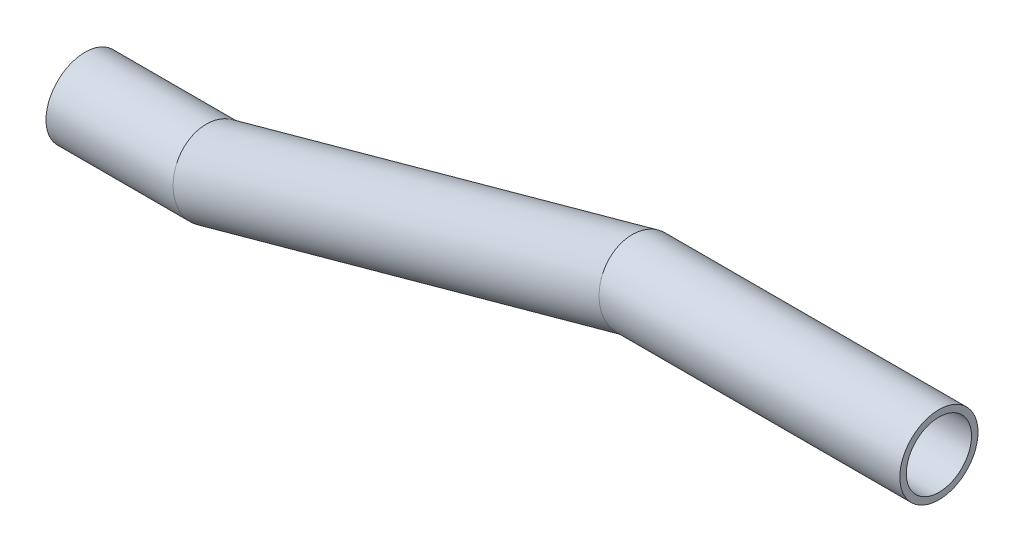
SolidWorks part; units mm, degrees
ref_plane "Ebene vorne" through (0, 0, 0) normal (0, 0, 1) x (1, 0, 0)
ref_plane "Ebene oben" through (0, 0, 0) normal (0, 1, 0) x (1, 0, 0)
ref_plane "Ebene rechts" through (0, 0, 0) normal (1, 0, 0) x (0, 0, -1)
ref_plane "Ebene1" through (-230, 0, 0) normal (1, 0, 0) x (0, 0, -1)
ref_plane "Ebene2" through (-597, 0, 0) normal (1, 0, 0) x (0, 0, -1)
ref_plane "Ebene3" through (-697, 0, 0) normal (1, 0, 0) x (0, 0, -1)
sketch "Skizze1" plane through (0, 0, 0) normal (1, 0, 0) x (0, 0, -1)
  point P0 (0, 0)
sketch "Skizze3" plane through (-230, 0, 0) normal (1, 0, 0) x (0, 0, -1)
  point P0 (0, 0)
  point P2 (0, 0)
sketch "Skizze4" plane through (-597, 0, 0) normal (1, 0, 0) x (0, 0, -1)
  point P0 (38.5, -129)
  dimension "D1" = 129
  dimension "D2" = 38.5
sketch "Skizze5" plane through (-697, 0, 0) normal (1, 0, 0) x (0, 0, -1)
  point P0 (38.5, -129)
  point P2 (38.5, -129)
sketch3d "3D-Skizze2"
  line L0 (0, 0, 0) -> (-230, 0, 0)
  line L1 (-230, 0, 0) -> (-597, -129, -38.5)
  line L2 (-597, -129, -38.5) -> (-697, -129, -38.5)
sketch "Skizze6" plane through (0, 0, 0) normal (1, 0, 0) x (0, 0, -1)
  circle A0 centre (0, 0) radius 30.15
  circle A1 centre (0, 0) radius 25.15
  dimension "D1" = 5
  dimension "D2" = 60.3
sweep "Austragung1" add profiles "Skizze6" path "3D-Skizze2"
